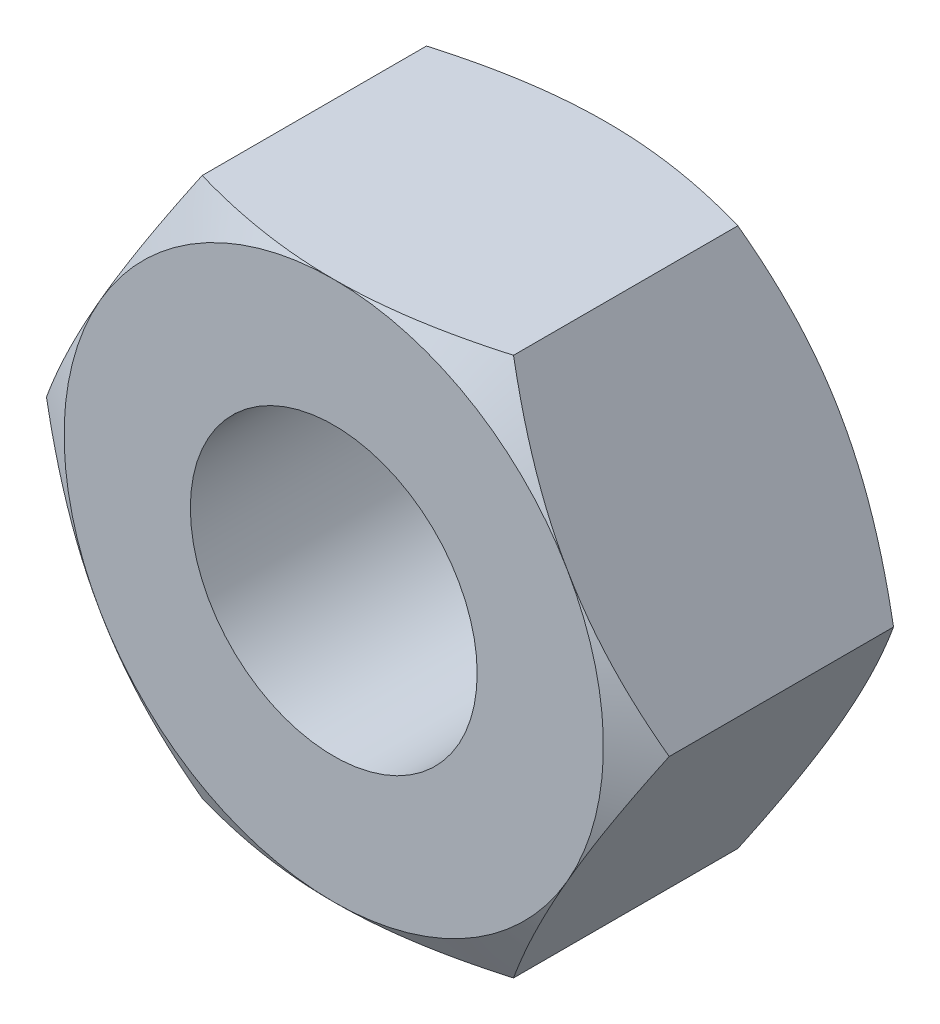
SolidWorks part; units mm, degrees
ref_plane "Plan de face" through (0, 0, 0) normal (0, 0, 1) x (1, 0, 0)
ref_plane "Plan de dessus" through (0, 0, 0) normal (0, 1, 0) x (1, 0, 0)
ref_plane "Plan de droite" through (0, 0, 0) normal (1, 0, 0) x (0, 0, -1)
imported_body "Importée3"
hole_wizard "Perçage1" positions "Esquisse2" profile "Esquisse1" legacy
sketch "Esquisse2" plane through (0, 0, 0) normal (0, 0, 1) x (1, 0, 0)
  point P0 (0, 0)
sketch "Esquisse1" plane through (0, 0, 0) normal (1, 0, 0) x (0, -1, 0)
  line L0 (0, 0) -> (0, 9.6)
  line L1 (0, 9.6) -> (5.0528, 9.6)
  line L2 (5.0528, 9.6) -> (5.0528, 0)
  line L3 (5.0528, 0) -> (0, 0)
  line L4 (0, 110) -> (0, -10) construction
  dimension "Diamètre" = 10.1056
  dimension "Profondeur" = 9.6
